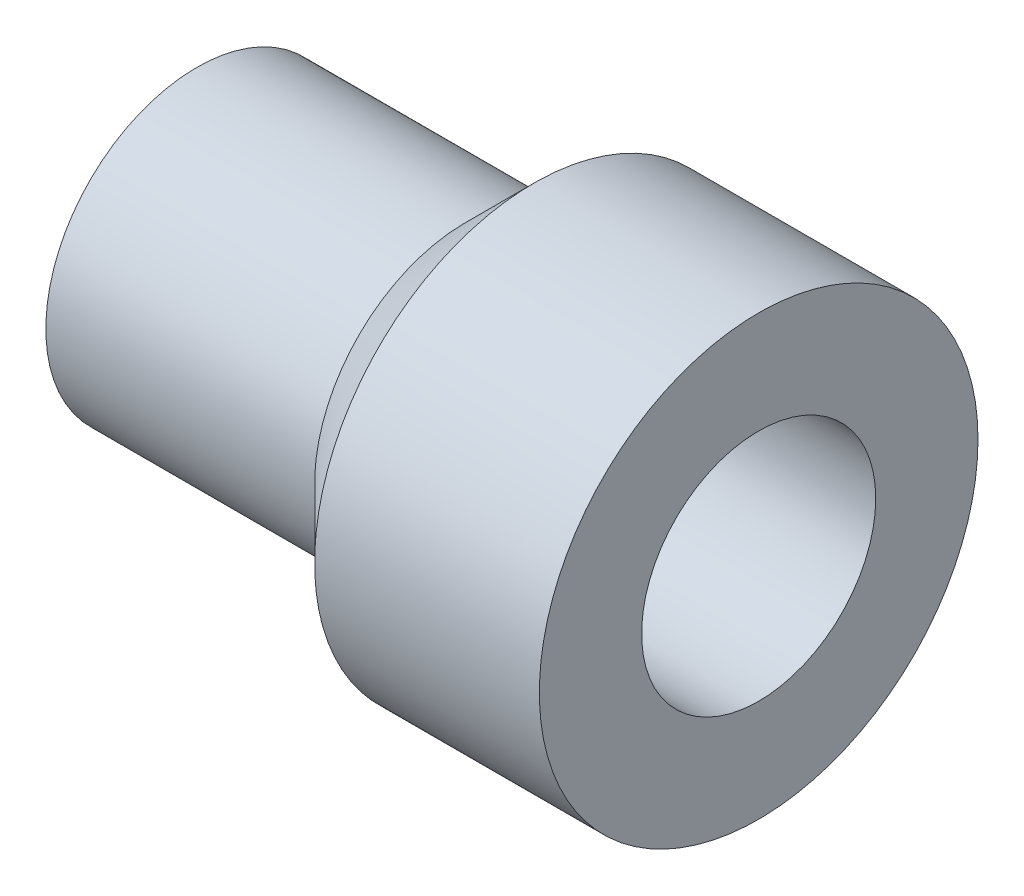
SolidWorks part; units mm, degrees
ref_plane "Front Plane" through (0, 0, 0) normal (0, 0, 1) x (1, 0, 0)
ref_plane "Top Plane" through (0, 0, 0) normal (0, 1, 0) x (1, 0, 0)
ref_plane "Right Plane" through (0, 0, 0) normal (1, 0, 0) x (0, 0, -1)
sketch "Sketch1" plane through (0, 0, 0) normal (1, 0, 0) x (0, 0, -1)
  circle A0 centre (0, 0) radius 4.03
  dimension "D1" = 8.06
extrude "Boss-Extrude1" add sketch "Sketch1" along normal blind 15
sketch "Sketch2" plane through (15, 0, 0) normal (1, 0, 0) x (0, 0, -1)
  circle A0 centre (0, 0) radius 3.125
  dimension "D1" = 6.25
extrude "Cut-Extrude1" cut sketch "Sketch2" against normal through all
sketch "Sketch3" plane through (15, 0, 0) normal (1, 0, 0) x (0, 0, -1)
  circle A0 centre (0, 0) radius 5.855
  circle A1 centre (0, 0) radius 4.03
  dimension "D1" = 11.71
extrude "Boss-Extrude2" add sketch "Sketch3" against normal blind 8
chamfer "Chamfer1" distance 2 angle 45 1 edges at (7, 0, -5.855)
